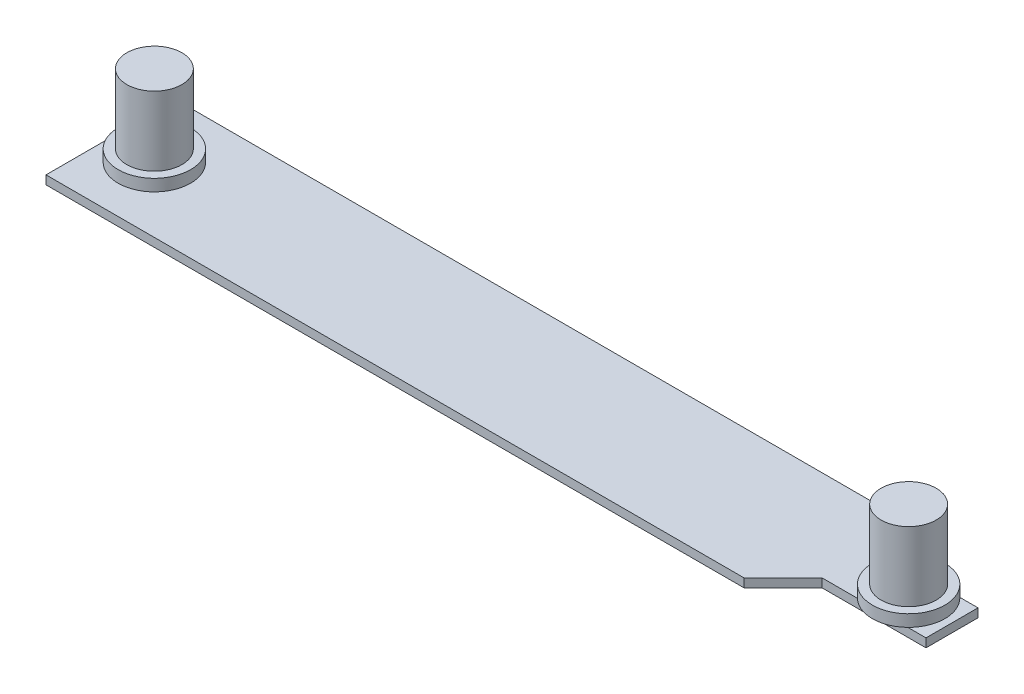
SolidWorks part; units mm, degrees
ref_plane "Front Plane" through (0, 0, 0) normal (0, 0, 1) x (1, 0, 0)
ref_plane "Top Plane" through (0, 0, 0) normal (0, 1, 0) x (1, 0, 0)
ref_plane "Right Plane" through (0, 0, 0) normal (1, 0, 0) x (0, 0, -1)
sketch "Sketch1" plane through (0, 0, 0) normal (0, 1, 0) x (1, 0, 0)
  line L0 (48.5, 3) -> (36.5, 3)
  line L2 (32, 7.5) -> (-48.5, 7.5)
  line L4 (36.5, 3) -> (32, 7.5)
  line L7 (-48.5, -7.5) -> (-48.5, 7.5)
  line L8 (48.5, -3) -> (36.5, -3)
  line L9 (48.5, -3) -> (48.5, 3)
  line L10 (32, -7.5) -> (-48.5, -7.5)
  line L12 (36.5, -3) -> (32, -7.5)
  point P0 (0, 0)
extrude "Boss-Extrude1" add sketch "Sketch1" along normal blind 1
sketch "Sketch2" plane through (0, 1, 0) normal (0, 1, 0) x (1, 0, 0)
  line L0 (-42.5, 0) -> (42.5, 0)
  circle A1 centre (-43.5, 0) radius 1
  circle A3 centre (43.5, 0) radius 1
  dimension "D3" = 2
  dimension "D4" = 2
  dimension "D8" = 85
sketch "Sketch4" plane through (0, 1, 0) normal (0, 1, 0) x (1, 0, 0)
  circle A1 centre (-43.5, 0) radius 4.18
  circle A3 centre (43.5, 0) radius 4.18
extrude "Boss-Extrude2" add sketch "Sketch4" along normal blind 1.36
sketch "Sketch5" plane through (0, 2.36, 0) normal (0, 1, 0) x (1, 0, 0)
  circle A1 centre (-43.5, 0) radius 3.18
  circle A3 centre (43.5, 0) radius 3.18
extrude "Boss-Extrude3" add sketch "Sketch5" along normal blind 8
